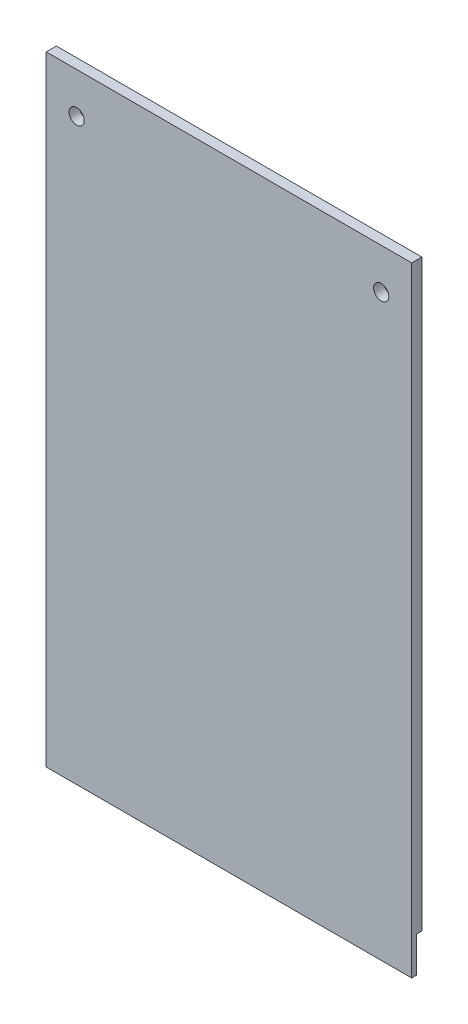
SolidWorks part; units mm, degrees
ref_plane "Front Plane" through (0, 0, 0) normal (0, 0, 1) x (1, 0, 0)
ref_plane "Top Plane" through (0, 0, 0) normal (0, 1, 0) x (1, 0, 0)
ref_plane "Right Plane" through (0, 0, 0) normal (1, 0, 0) x (0, 0, -1)
sketch "Sketch2" plane through (0, 0, 0) normal (0, 0, 1) x (1, 0, 0)
  line L1 (-36, 122) -> (36, 122)
  line L2 (-36, 122) -> (-36, -122)
  line L3 (-36, -122) -> (36, -122)
  line L4 (36, 122) -> (36, -122)
  line L5 (-36, 122) -> (36, -122) construction
  line L6 (-36, -122) -> (36, 122) construction
  point P0 (0, 0)
  dimension "D1" = 244
  dimension "D2" = 72
extrude "Boss-Extrude1" add sketch "Sketch2" along normal blind 2
sketch "Sketch3" plane through (0, 0, 2) normal (0, 0, 1) x (1, 0, 0)
  line L0 (86.8288, 114) -> (-86.8288, 114) construction
  line L1 (-92.684, -114) -> (92.684, -114) construction
  line L2 (36, 122) -> (-36, 122) construction
  line L3 (36, -122) -> (36, 122) construction
  line L4 (-36, 122) -> (-36, -122) construction
  circle A0 centre (30, 114) radius 1.5
  circle A1 centre (-30, 114) radius 1.5
  circle A2 centre (30, -114) radius 1.5
  circle A3 centre (-30, -114) radius 1.5
  point P3 (0, 114)
  point P6 (0, -114)
  dimension "D3" = 3
  dimension "D6" = 6
  dimension "D1" = 8
  dimension "D2" = 8
  dimension "D4" = 6
  dimension "D5" = 6
  dimension "D7" = 6
extrude "Cut-Extrude1" cut sketch "Sketch3" against normal through all
sketch "Sketch4" plane through (0, 0, 2) normal (0, 0, 1) x (1, 0, 0)
  line L0 (-36, -122) -> (-36, 0)
  line L1 (-36, 122) -> (-36, -122) construction
  line L2 (-36, 0) -> (36, 0)
  line L3 (36, -122) -> (36, 122) construction
  line L4 (36, 0) -> (36, -122)
  line L5 (36, -122) -> (-36, -122)
  dimension "D1" = 122
extrude "Cut-Extrude2" cut sketch "Sketch4" against normal through all
sketch "Sketch5" plane through (36, 0, 0) normal (1, 0, 0) x (0, 0, -1)
  line L0 (0, 0) -> (-1, 0)
  line L1 (0, 0) -> (-2, 0) construction
  line L2 (-1, 0) -> (-1, 7)
  line L3 (-1, 7) -> (0, 7)
  line L4 (0, 0) -> (0, 122) construction
  line L5 (0, 7) -> (0, 0)
  dimension "D1" = 7
extrude "Cut-Extrude3" cut sketch "Sketch5" against normal through all
